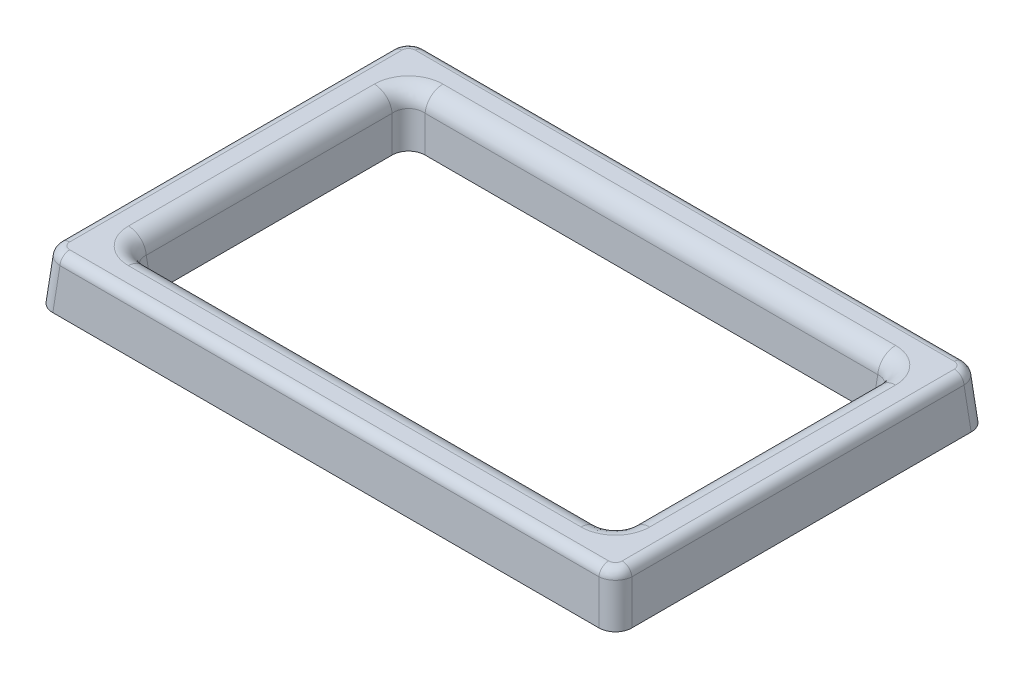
SolidWorks part; units mm, degrees
ref_plane "Front Plane" through (0, 0, 0) normal (0, 0, 1) x (1, 0, 0)
ref_plane "Top Plane" through (0, 0, 0) normal (0, 1, 0) x (1, 0, 0)
ref_plane "Right Plane" through (0, 0, 0) normal (1, 0, 0) x (0, 0, -1)
imported_body "Imported1"
fillet "Fillet1" radius 2.75
fillet "Fillet2" radius 1.5 28 edges
